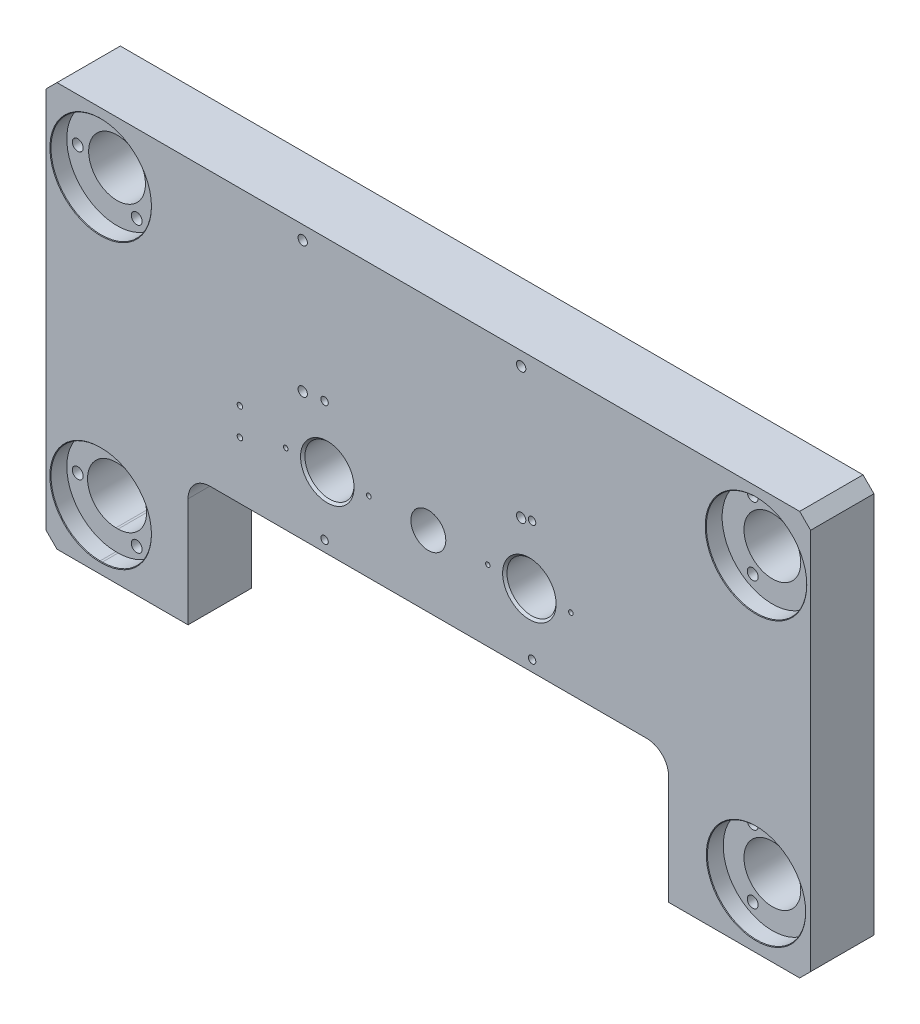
SolidWorks part; units mm, degrees
ref_plane "Frontal" through (0, 0, 0) normal (0, 0, 1) x (1, 0, 0)
ref_plane "Horizontal" through (0, 0, 0) normal (0, 1, 0) x (1, 0, 0)
ref_plane "Vertical" through (0, 0, 0) normal (1, 0, 0) x (0, 0, -1)
imported_body "Importée1"
other "SupprimerFace2"
hole_wizard "Trou taraudé M101" positions "Esquisse4" profile "Esquisse3" tap size "M10" standard "ISO"
sketch "Esquisse4" plane through (0, 0, 58) normal (0, 0, 1) x (1, 0, 0)
  line L0 (-15, 0) -> (-15, 185) construction
  line L1 (340, 185) -> (-340, 185) construction
  line L2 (-157.9038, 172.5) -> (141.3982, 172.5) construction
  line L3 (141.3982, 52.5) -> (-157.9038, 52.5) construction
  line L4 (85, 172.5) -> (85, 37.4127) construction
  line L5 (-115, 172.5) -> (-115, 37.4127) construction
  point P0 (85, 172.5)
  point P10 (-115, 172.5)
  point P19 (85, 52.5)
  point P21 (-115, 52.5)
  dimension "D1" = 12.5
  dimension "D2" = 200
  dimension "D3" = 15
  dimension "D4" = 120
sketch "Esquisse3" plane through (85, 172.5, 58) normal (1, 0, 0) x (0, -1, 0)
  line L0 (0, 0) -> (0, 30.0537)
  line L1 (0, 30.0537) -> (4.25, 27.5)
  line L2 (4.25, 27.5) -> (4.25, 0)
  line L5 (4.25, 0) -> (0, 0)
  line L10 (0, 30.0537) -> (-4.25, 27.5) construction
  line L11 (0, -6.35) -> (0, 107.95) construction
  dimension "Diamètre du trou pour taraudage" = 8.5
  dimension "Profondeur du trou pour taraudage" = 27.5
  dimension "Angle de pointe" = 118
other "SupprimerFace3"
other "SupprimerFace4"
other "SupprimerFace5"
other "SupprimerFace6"
sketch "Esquisse5" plane through (0, 0, 58) normal (0, 0, 1) x (1, 0, 0)
  circle A2 centre (0, 0) radius 16
  dimension "D1" = 32
extrude "Extrusion1" cut sketch "Esquisse5" against normal through all
hole_wizard "Trou taraudé M81" positions "Esquisse8" profile "Esquisse7" tap size "M8" standard "ISO"
sketch "Esquisse8" plane through (0, 0, 58) normal (0, 0, 1) x (1, 0, 0)
  line L0 (0, -128.9044) -> (0, 212.6651) construction
  line L1 (-215.3846, 0) -> (222.9992, 0) construction
  point P0 (-95, 55)
  point P11 (95, 55)
  point P12 (95, -55)
  point P13 (-95, -55)
  dimension "D1" = 190
  dimension "D2" = 110
sketch "Esquisse7" plane through (-95, 55, 58) normal (1, 0, 0) x (0, -1, 0)
  line L0 (0, 0) -> (0, 58)
  line L1 (0, 58) -> (3.4, 58)
  line L2 (3.4, 58) -> (3.4, 0)
  line L5 (3.4, 0) -> (0, 0)
  line L11 (0, -6.35) -> (0, 107.95) construction
  dimension "Diamètre du trou pour taraudage jusqu'au prochain" = 6.8
  dimension "Profondeur du trou pour taraudage jusqu'au prochain" = 58
hole_wizard "Trou taraudé M61" positions "Esquisse10" profile "Esquisse9" tap size "M6" standard "ISO"
sketch "Esquisse10" plane through (0, 0, 58) normal (0, 0, 1) x (1, 0, 0)
  line L0 (-172.5, -12.5) -> (-172.5, 49.2281) construction
  circle A0 centre (-95, -55) radius 3.4 construction
  point P0 (-172.5, -12.5)
  point P5 (-172.5, 12.5)
  dimension "D1" = 42.5
  dimension "D3" = 77.5
  dimension "D2" = 25
sketch "Esquisse9" plane through (-172.5, -12.5, 58) normal (1, 0, 0) x (0, -1, 0)
  line L0 (0, 0) -> (0, 58)
  line L1 (0, 58) -> (2.5, 58)
  line L2 (2.5, 58) -> (2.5, 0)
  line L5 (2.5, 0) -> (0, 0)
  line L11 (0, -6.35) -> (0, 107.95) construction
  dimension "Diamètre du trou pour taraudage jusqu'au prochain" = 5
  dimension "Profondeur du trou pour taraudage jusqu'au prochain" = 58
